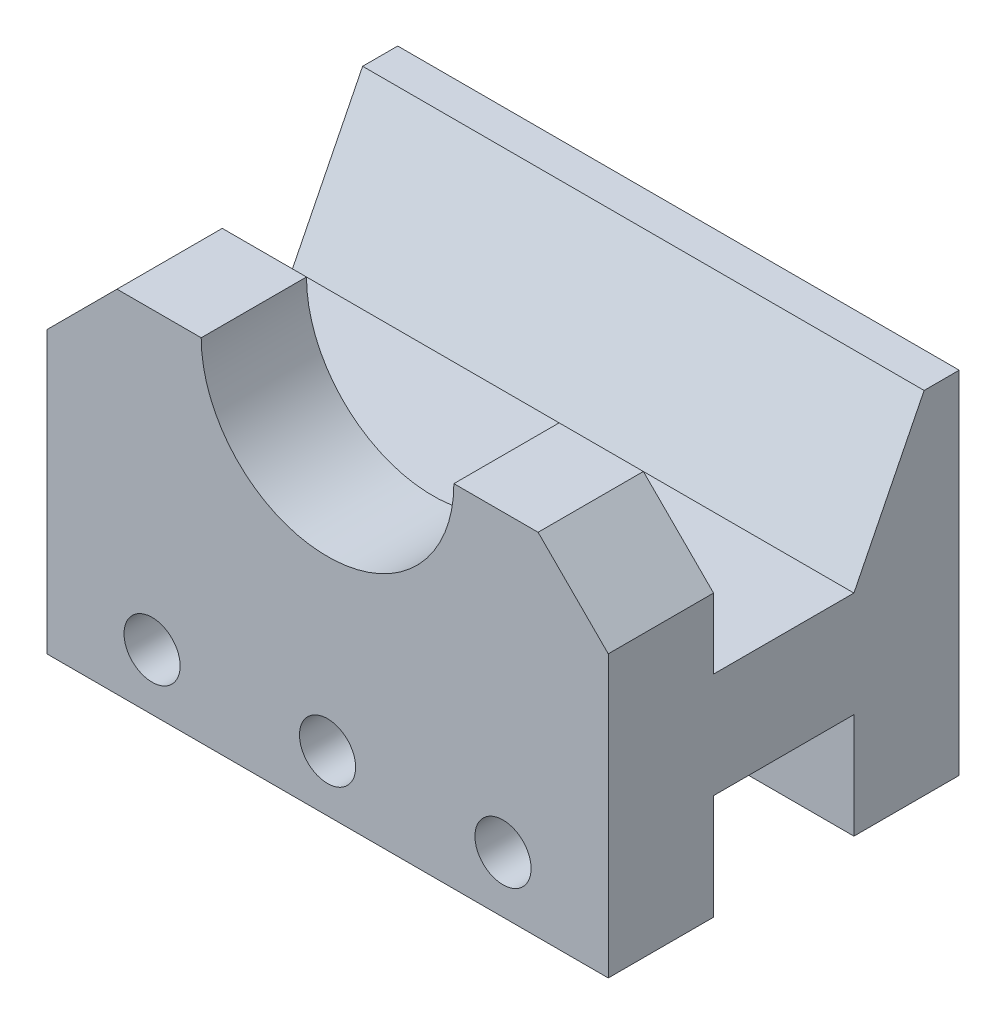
SolidWorks part; units mm, degrees
ref_plane "正面" through (0, 0, 0) normal (0, 0, 1) x (1, 0, 0)
ref_plane "平面" through (0, 0, 0) normal (0, 1, 0) x (1, 0, 0)
ref_plane "右側面" through (0, 0, 0) normal (1, 0, 0) x (0, 0, -1)
sketch "ｽｹｯﾁ1" plane through (0, 0, 0) normal (0, 1, 0) x (1, 0, 0)
  line L1 (0, 0) -> (80, 0)
  line L2 (0, 0) -> (0, 50)
  line L3 (0, 50) -> (80, 50)
  line L4 (80, 0) -> (80, 50)
  dimension "D1" = 80
  dimension "D2" = 50
extrude "押し出し1" add sketch "ｽｹｯﾁ1" along normal blind 50
sketch "ｽｹｯﾁ2" plane through (0, 0, 0) normal (-1, 0, 0) x (0, 0, 1)
  line L0 (-50, 0) -> (0, 0) construction
  line L1 (-35, 0) -> (-15, 0)
  line L2 (-35, 0) -> (-35, 15)
  line L3 (-35, 15) -> (-15, 15)
  line L4 (-15, 0) -> (-15, 15)
  line L5 (-50, 50) -> (-50, 0) construction
  line L6 (0, 50) -> (0, 0) construction
  dimension "D1" = 15
  dimension "D2" = 15
  dimension "D3" = 15
extrude "ｶｯﾄ - 押し出し1" cut sketch "ｽｹｯﾁ2" against normal through all
sketch "ｽｹｯﾁ3" plane through (0, 0, 0) normal (-1, 0, 0) x (0, 0, 1)
  line L0 (-15, 50) -> (-15, 30)
  line L1 (0, 50) -> (-50, 50) construction
  line L2 (-15, 30) -> (-35, 30)
  line L3 (-35, 30) -> (-45, 50)
  line L4 (-45, 50) -> (-15, 50)
  line L5 (-15, 0) -> (-15, 15) construction
  line L6 (-50, 50) -> (-50, 0) construction
  line L7 (-15, 15) -> (-35, 15) construction
  line L8 (-35, 15) -> (-35, 0) construction
  dimension "D1" = 5
  dimension "D2" = 15
extrude "ｶｯﾄ - 押し出し2" cut sketch "ｽｹｯﾁ3" against normal through all
sketch "ｽｹｯﾁ4" plane through (0, 0, 0) normal (0, 0, 1) x (1, 0, 0)
  line L0 (0, 50) -> (80, 50) construction
  circle A0 centre (40, 50) radius 18
  dimension "D1" = 18
extrude "ｶｯﾄ - 押し出し3" cut sketch "ｽｹｯﾁ4" against normal up to next
chamfer "面取り1" distance 10 angle 45 2 edges at (80, 50, -7.5) (0, 50, -7.5)
sketch "ｽｹｯﾁ5" plane through (0, 0, 0) normal (0, 0, 1) x (1, 0, 0)
  line L0 (40, 50) -> (40, 0) construction
  line L1 (80, 50) -> (0, 50) construction
  line L2 (0, 0) -> (80, 0) construction
  line L3 (15, 8) -> (65, 8) construction
  circle A0 centre (15, 8) radius 4
  circle A1 centre (40, 8) radius 4
  circle A2 centre (65, 8) radius 4
  point P8 (40, 8)
  dimension "D1" = 8
  dimension "D2" = 25
  dimension "D4" = 25
  dimension "D3" = 8
extrude "ｶｯﾄ - 押し出し4" cut sketch "ｽｹｯﾁ5" against normal through all
